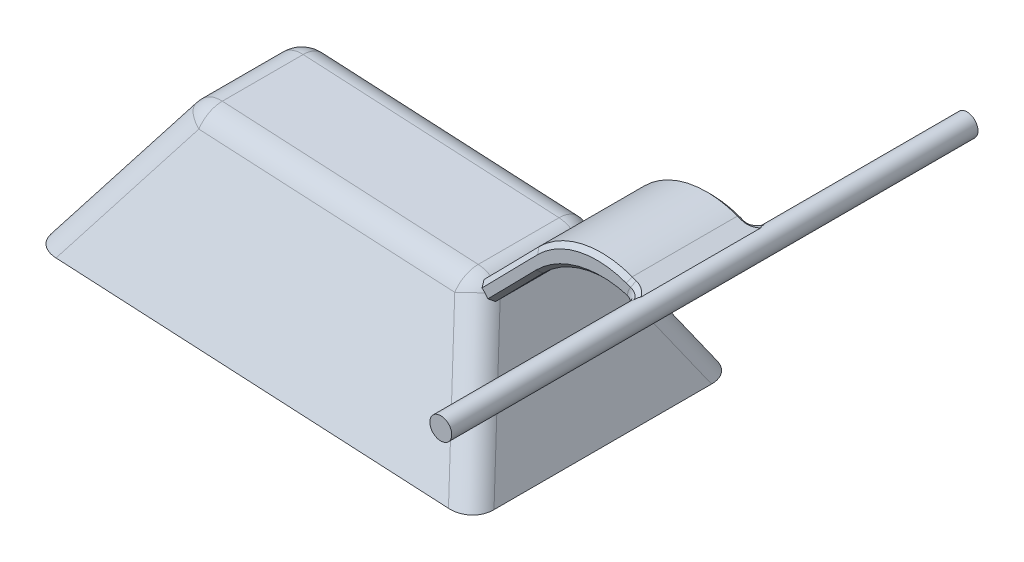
SolidWorks part; units mm, degrees
ref_plane "前视基准面" through (0, 0, 0) normal (0, 0, 1) x (1, 0, 0)
ref_plane "上视基准面" through (0, 0, 0) normal (0, 1, 0) x (1, 0, 0)
ref_plane "右视基准面" through (0, 0, 0) normal (1, 0, 0) x (0, 0, -1)
sketch "草图1" plane through (85.9411, -2.2504, 0) normal (-0.0523, -0.9986, 0) x (-0.9986, 0.0523, 0)
  line L0 (85.9411, -0.7) -> (106.5251, -0.7) construction
  line L1 (85.9411, -0.7) -> (85.9411, 65.9098) construction
  line L3 (49.8394, -15.7) -> (99.8394, -15.7)
  line L4 (49.8394, -15.7) -> (49.8394, 14.3)
  line L5 (49.8394, 14.3) -> (99.8394, 14.3)
  line L6 (99.8394, -15.7) -> (99.8394, 14.3)
  line L7 (49.8394, -15.7) -> (99.8394, 14.3) construction
  line L8 (49.8394, 14.3) -> (99.8394, -15.7) construction
  point P1 (99.8394, -0.7)
  dimension "D1" = 50
  dimension "D2" = 30
extrude "凸台-拉伸1" add sketch "草图1" against normal blind 15 draft 30
sketch "草图2" plane through (0, 0, 0) normal (0, 0, 1) x (1, 0, 0)
  line L0 (47, 20) -> (47, 25.6367) construction
  line L1 (45.5, 20) -> (48.5, 20) construction
  circle A0 centre (47, 22.25) radius 1.25
  dimension "D1" = 2.5
  dimension "D2" = 1
extrude "凸台-拉伸2" add sketch "草图2" along normal mid plane 60 separate body
sketch "草图3" plane through (0, 0, 0) normal (0, 0, 1) x (1, 0, 0)
  line L0 (22.5172, 8.4697) -> (39, 25.25)
  line L1 (39, 25.25) -> (47, 22.25)
  dimension "D1" = 3
  dimension "D2" = 8
  dimension "D3" = 1
extrude "拉伸-薄壁1" add sketch "草图3" along normal mid plane 13 thin
fillet "圆角1" radius 10 2 edges at (39.2577, 24.0853, 0) (38.7423, 26.4147, 0)
fillet "圆角2" radius 1 2 edges at (45.8296, 22.6889, -6.5) (45.8296, 22.6889, 6.5)
fillet "圆角3" radius 3 8 edges at (-4.3281, 17.5009, 0.7) (11.9893, 16.6458, 7.0397) (28.3066, 15.7906, 0.7) (11.9893, 16.6458, -5.6397) (32.2383, 8.0743, 11.3699) (-9.0448, 10.2378, 11.3699) (32.2383, 8.0743, -9.9699) (-9.0448, 10.2378, -9.9699)
chamfer "倒角1" distance 0.5 angle 45 16 edges at (45.7738, 21.6418, 7.0273) (44.8874, 21.9616, 6.507) (39.3751, 22.1315, 6.5) (28.9658, 13.6077, 6.5) (45.8814, 21.6015, -7.2098) (45.2383, 21.8419, -6.6028) (39.3751, 22.1315, -6.5) (28.9658, 13.6077, -6.5) (46.476, 23.5145, -7.0273) (45.1474, 24.0127, -6.5) (39.1589, 24.5319, -6.5) (27.9947, 15.4731, -6.5) (46.2931, 23.5831, 6.8286) (45.1474, 24.0127, 6.5) (27.9947, 15.4731, 6.5) (39.1589, 24.5319, 6.5)
